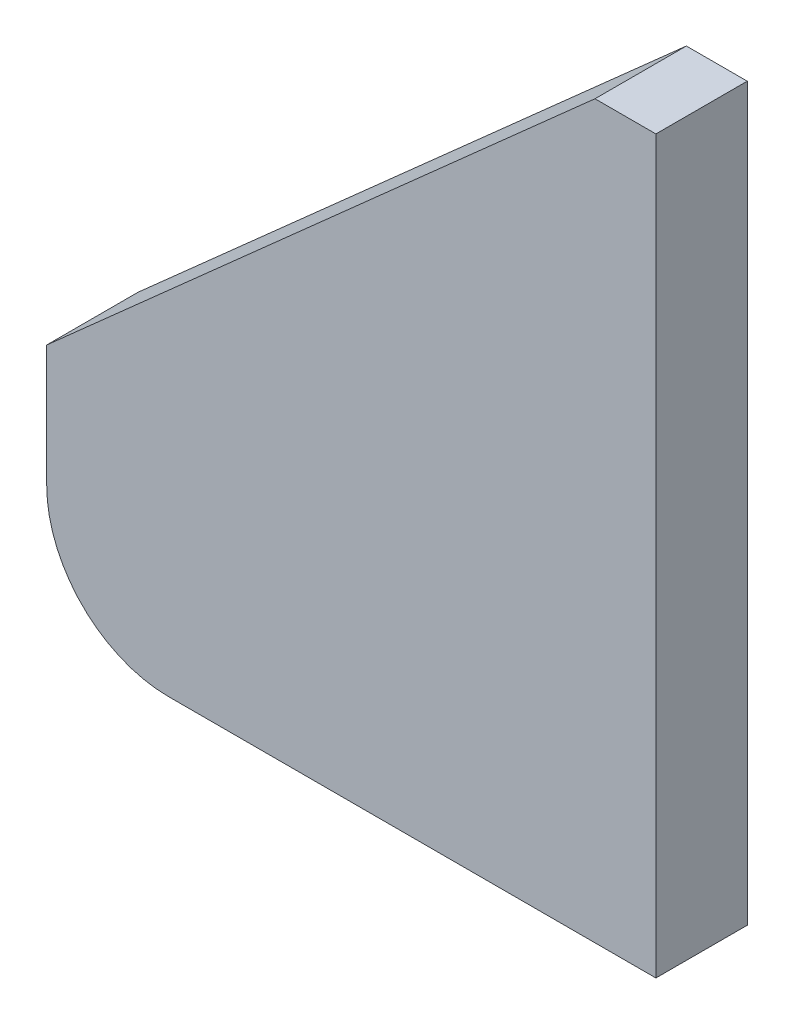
SolidWorks part; units mm, degrees
ref_plane "Face" through (0, 0, 0) normal (0, 0, 1) x (1, 0, 0)
ref_plane "Dessus" through (0, 0, 0) normal (0, 1, 0) x (1, 0, 0)
ref_plane "Droite" through (0, 0, 0) normal (1, 0, 0) x (0, 0, -1)
sketch "Esquisse1" plane through (0, 0, 0) normal (0, 0, 1) x (1, 0, 0)
  line L0 (-10, 120) -> (-100, 40)
  line L1 (-10, 120) -> (0, 120)
  line L2 (-100, 40) -> (-100, 20)
  line L3 (-80, 0) -> (0, 0)
  line L4 (0, 120) -> (0, 0)
  arc A0 (-80, 0) -> (-100, 20) centre (-80, 20) cw
  point P6 (-100, 0)
  dimension "D5" = 20
  dimension "D1" = 10
  dimension "D2" = 40
  dimension "D3" = 100
  dimension "D4" = 120
extrude "Base-Extrusion" add sketch "Esquisse1" along normal blind 15
